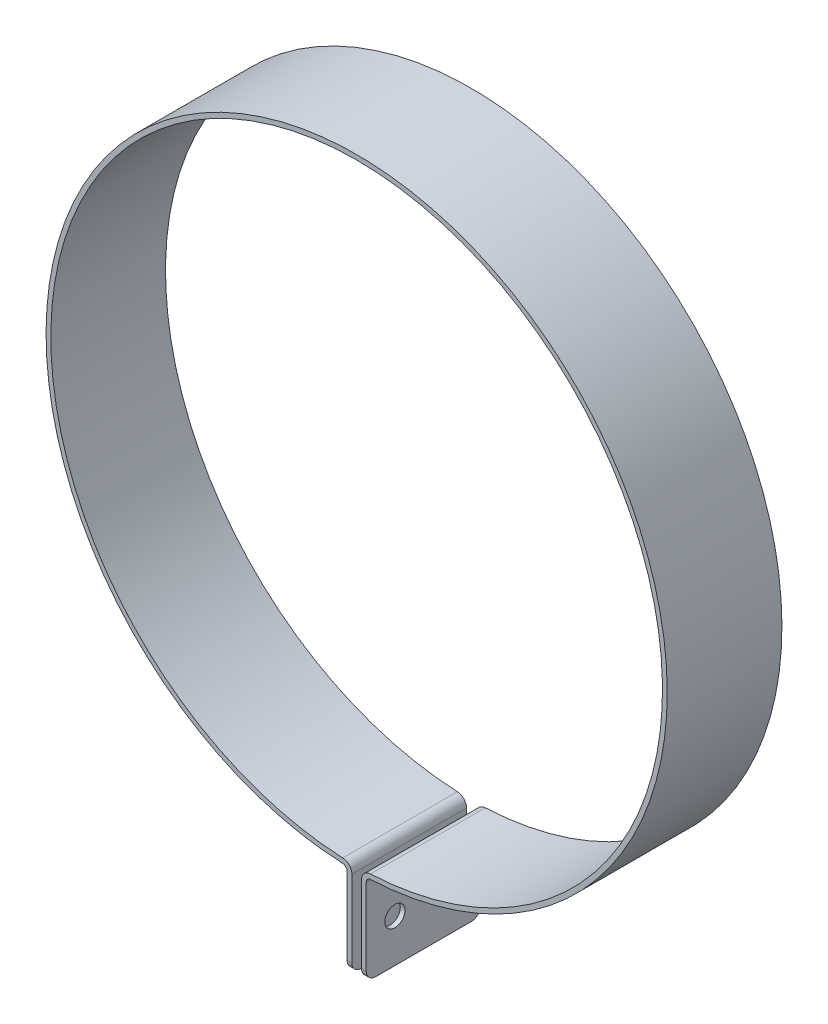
SolidWorks part; units mm, degrees
ref_plane "Front Plane" through (0, 0, 0) normal (0, 0, 1) x (1, 0, 0)
ref_plane "Top Plane" through (0, 0, 0) normal (0, 1, 0) x (1, 0, 0)
ref_plane "Right Plane" through (0, 0, 0) normal (1, 0, 0) x (0, 0, -1)
sketch "Sketch1" plane through (0, 0, 0) normal (0, 0, 1) x (1, 0, 0)
  circle A0 centre (0, 0) radius 101.6
  circle A1 centre (0, 0) radius 103.1748
  dimension "D1" = 203.2
  dimension "D2" = 1.5748
extrude "Boss-Extrude1" add sketch "Sketch1" against normal blind 38.1
sketch "Sketch2" plane through (0, 0, 0) normal (0, 0, 1) x (1, 0, 0)
  line L1 (-3.175, -133.35) -> (3.175, -133.35)
  line L2 (-3.175, -133.35) -> (-3.175, -101.6)
  line L3 (-3.175, -101.6) -> (3.175, -101.6)
  line L4 (3.175, -133.35) -> (3.175, -101.6)
  circle A0 centre (0, 0) radius 101.6 construction
  dimension "D1" = 3.175
  dimension "D2" = 3.175
  dimension "D3" = 31.75
extrude "Boss-Extrude2" add sketch "Sketch2" against normal blind 38.1
sketch "Sketch3" plane through (0, 0, 0) normal (0, 0, 1) x (1, 0, 0)
  line L0 (-3.175, -103.1259) -> (-3.175, -133.35) construction
  line L1 (-1.6002, -139.7) -> (1.6002, -139.7)
  line L2 (-1.6002, -139.7) -> (-1.6002, -95.25)
  line L3 (-1.6002, -95.25) -> (1.6002, -95.25)
  line L4 (1.6002, -139.7) -> (1.6002, -95.25)
  line L5 (3.175, -133.35) -> (3.175, -103.1259) construction
  line L6 (-3.175, -133.35) -> (3.175, -133.35) construction
  dimension "D1" = 1.5748
  dimension "D2" = 1.5748
  dimension "D3" = 6.35
  dimension "D4" = 44.45
extrude "Cut-Extrude1" cut sketch "Sketch3" against normal through all
fillet "Fillet1" radius 1.5748 2 edges at (-3.175, -103.1259, -19.05) (3.175, -103.1259, -19.05)
fillet "Fillet2" radius 3.175 6 edges at (-1.6002, -101.5874, -19.05) (1.6002, -101.5874, -19.05) (2.3876, -133.35, -38.1) (2.3876, -133.35, 0) (-2.3876, -133.35, 0) (-2.3876, -133.35, -38.1)
sketch "Sketch4" plane through (3.175, 0, 0) normal (1, 0, 0) x (0, 0, -1)
  line L0 (34.925, -133.35) -> (3.175, -133.35) construction
  line L1 (0, -130.175) -> (0, -104.6419) construction
  line L2 (38.1, -130.175) -> (38.1, -104.6419) construction
  circle A0 centre (9.525, -119.0752) radius 3.3655
  circle A1 centre (28.575, -119.0752) radius 3.3655
  dimension "D1" = 6.731
  dimension "D2" = 6.731
  dimension "D3" = 14.2748
  dimension "D4" = 14.2748
  dimension "D5" = 9.525
  dimension "D6" = 9.525
extrude "Cut-Extrude2" cut sketch "Sketch4" against normal through all
